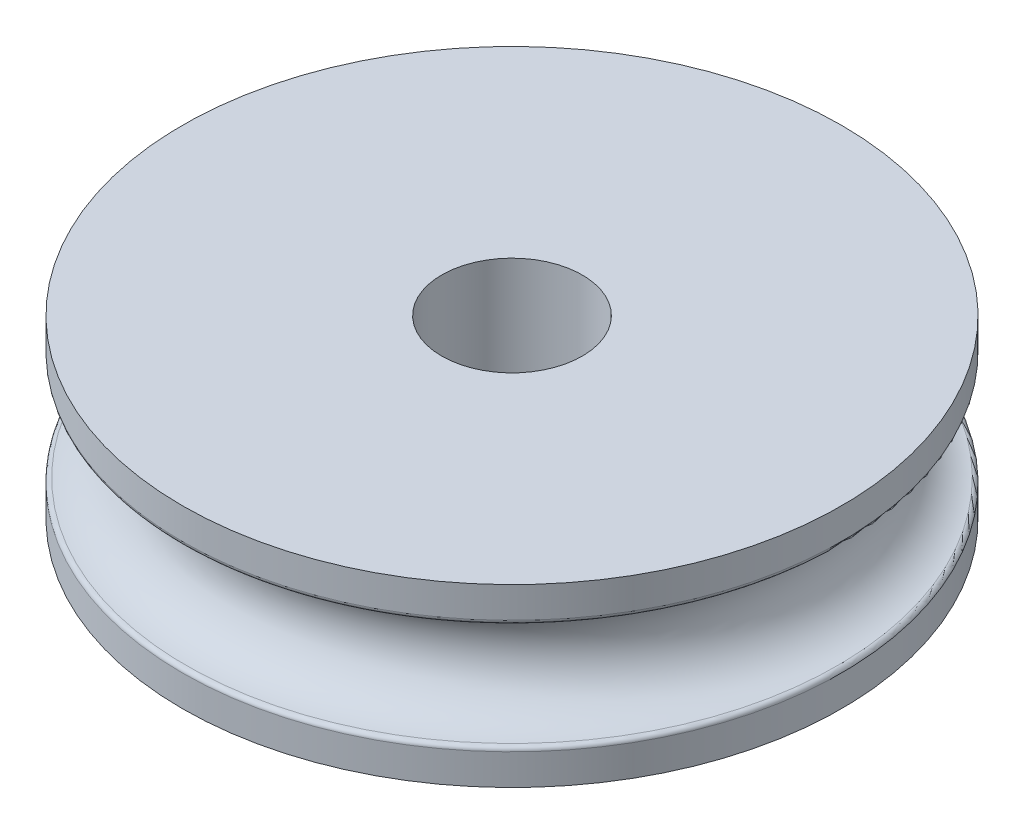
SolidWorks part; units mm, degrees
ref_plane "Alzado" through (0, 0, 0) normal (0, 0, 1) x (1, 0, 0)
ref_plane "Planta" through (0, 0, 0) normal (0, 1, 0) x (1, 0, 0)
ref_plane "Vista lateral" through (0, 0, 0) normal (1, 0, 0) x (0, 0, -1)
sketch "Croquis1" plane through (0, 0, 0) normal (0, 0, 1) x (1, 0, 0)
  line L0 (7.5, 3.2961) -> (7.5, 4)
  line L1 (0, 0) -> (7.5, 0)
  line L2 (0, 0) -> (0, 4)
  line L3 (0, 4) -> (7.5, 4)
  line L4 (7.5, 0) -> (7.5, 0.7039)
  arc A0 (7.4077, 3.1964) -> (7.4077, 0.8036) centre (7.5, 2) ccw
  arc A1 (7.4077, 0.8036) -> (7.5, 0.7039) centre (7.4, 0.7039) cw
  arc A2 (7.4077, 3.1964) -> (7.5, 3.2961) centre (7.4, 3.2961) ccw
  dimension "D3" = 0.1
  dimension "D1" = 4
  dimension "D2" = 7.5
revolve "Revolución1" add sketch "Croquis1" angle 360 about L2
sketch "Croquis2" plane through (0, 4, 0) normal (0, 1, 0) x (1, 0, 0)
  circle A0 centre (0, 0) radius 1.6
extrude "Cortar-Extruir1" cut sketch "Croquis2" against normal through all
